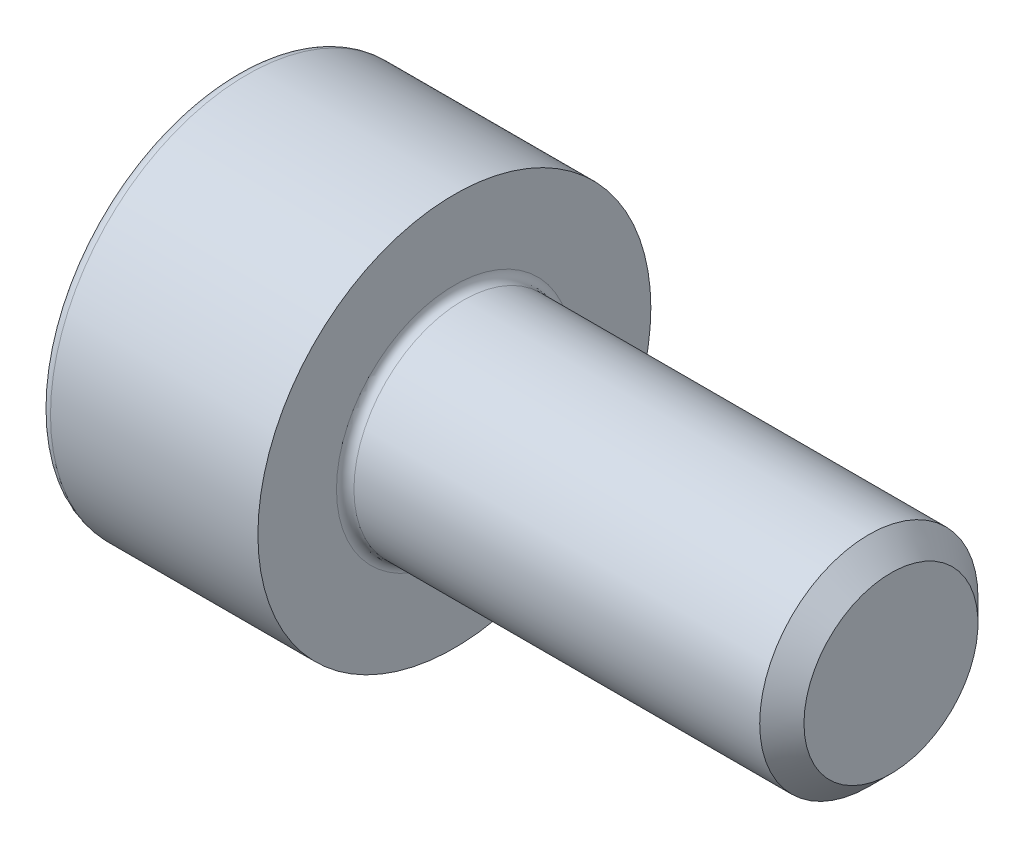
SolidWorks part; units mm, degrees
revolve "Base-Revolve" add sketch "BodySke"
sketch "BodySke" plane through (0, 0, 0) normal (0, 0, 1) x (1, 0, 0)
  line L0 (0, 0) -> (0, 2.25)
  line L1 (0, 2.25) -> (2.5, 2.25)
  line L2 (2.5, 2.25) -> (2.5, 1.25)
  line L3 (2.5, 1.25) -> (7.2465, 1.25)
  line L4 (7.5, 0.9965) -> (7.5, 0)
  line L5 (7.5, 0) -> (0, 0)
  line L6 (-31.75, 0) -> (127, 0) construction
  line L8 (7.5, 0.9965) -> (7.2465, 1.25)
  line L10 (7.5, -0.9965) -> (7.2465, -1.25) construction
  line L11 (2.95, 0.1695) -> (2.95, -6.1805) construction
  line L12 (3.5, 0.1695) -> (3.5, -6.1805) construction
  line L13 (-52.5, 0.1695) -> (-52.5, -6.1805) construction
fillet "Fillet1" radius 0.1 1 edges at (2.5, 0, 1.25)
fillet "Fillet2" radius 0.125 1 edges at (0, 0, 2.25)
ref_plane "Plane1" through (0, 0, 0) normal (0, 0, 1) x (1, 0, 0)
ref_plane "Plane2" through (0, 0, 0) normal (0, 1, 0) x (1, 0, 0)
ref_plane "Plane3" through (0, 0, 0) normal (1, 0, 0) x (0, 0, -1)
sketch "Sketch2" plane through (0, 0, 0) normal (0, 0, 1) x (1, 0, 0)
  line L0 (0, 1.0225) -> (1.1, 1.0225)
  line L1 (1.1, 1.0225) -> (1.6903, 0)
  line L2 (-31.75, 0) -> (127, 0) construction
  line L3 (1.6903, 0) -> (0, 0)
  line L4 (0, 0) -> (0, 1.0225)
  line L6 (0, 0) -> (47.625, 0) construction
revolve "Hex-PreBroach" cut sketch "Sketch2" angle 360 about L6
sketch "Sketch3" plane through (0, 0, 0) normal (-1, 0, 0) x (0, 0.5, 0.866)
  line L0 (0.5903, 1.0225) -> (-0.5903, 1.0225)
  line L1 (-0.5903, 1.0225) -> (-1.1807, 0)
  line L2 (0.5903, 1.0225) -> (1.1807, 0)
  line L3 (0.5903, -1.0225) -> (1.1807, 0)
  line L4 (0.5903, -1.0225) -> (-0.5903, -1.0225)
  line L5 (-0.5903, -1.0225) -> (-1.1807, 0)
extrude "Hex" cut sketch "Sketch3" against normal blind 1.1
sketch "ThdSchSke" plane through (0, 0, 0) normal (0, 0, 1) x (1, 0, 0)
  line L0 (3.85, -0.9965) -> (3.6725, -1.25)
  line L1 (3.85, -0.9965) -> (4.0275, -1.25)
  line L2 (4.0275, -1.25) -> (4.0275, -1.5625)
  line L3 (-3.175, 0) -> (5.1513, 0) construction
  line L4 (0, 2.125) -> (0, -2.125) construction
  line L5 (4.0275, -1.5625) -> (3.6725, -1.5625)
  line L6 (3.6725, -1.5625) -> (3.6725, -1.25)
revolve "ThreadSchematic" [suppressed] cut sketch "ThdSchSke" angle 360 about L3
pattern_linear "ThdSchPat" [suppressed]
equation "\"D2@Sketch3\" = \"Hex_size@Sketch3\" / 2"
equation "\"D1@Sketch3\" = \"Hex_size@Sketch3\" / 2"
equation "\"D1@Sketch2\" = \"Hex_size@Sketch3\" / 2"
equation "\"Thread_minor@ThreadCosmetic\"  =  \"Minor_dia@BodySke\""
equation "\"Depth@Sketch2\" =  \"Key_eng@Hex\""
equation "\"Thread_length@ThreadCosmetic\" = ((sgn( (\"Length@BodySke\" - \"Advance@BodySke\" * 3.0) - \"Thread_nom@BodySke\" )-1)*( (\"Length@BodySke\" - \"Advance@BodySke\" * 3.0) - \"Thread_nom@BodySke\" ))/-2+ \"Thread_no"
equation "\"Thread_minor@ThdSchSke\" = \"Minor_dia@BodySke\""
equation "\"Diameter@ThdSchSke\" = \"Diameter@BodySke\""
equation "\"Overcut@ThdSchSke\" = \"Diameter@BodySke\" * 1.25"
equation "\"Start@ThdSchSke\" = \"Head_ht@BodySke\" + \"Length@BodySke\" - \"Thread_length@ThreadCosmetic\"  '---Non-countersunk---"
equation "\"Num_threads@ThdSchPat\" = int( \"Thread_length@ThreadCosmetic\" / \"Advance@BodySke\" + 0.999 )  + 1"
equation "\"Advance@ThdSchPat\" = \"Thread_length@ThreadCosmetic\" /  (\"Num_threads@ThdSchPat\" - 1) 'relax it"
equation "\"Num_threads@ThdSchPat\" = \"Num_threads@ThdSchPat\" - sgn( \"Num_threads@ThdSchPat\" - 1) '---chamfered tips only---"
